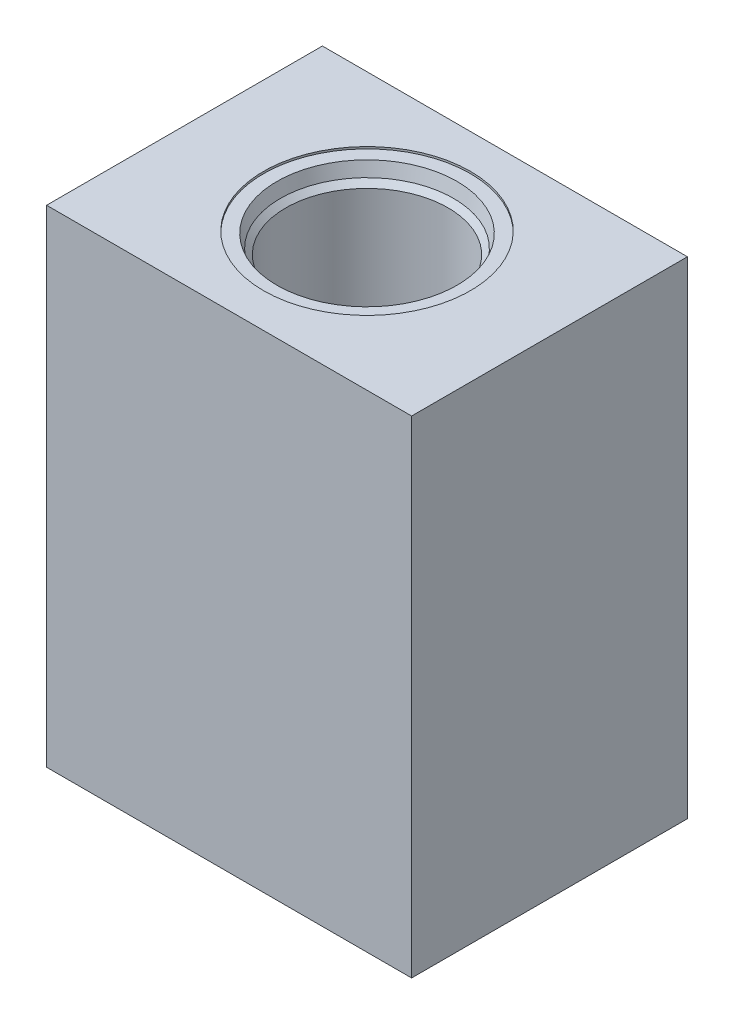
SolidWorks part; units mm, degrees
ref_plane "Ebene vorne" through (0, 0, 0) normal (0, 0, 1) x (1, 0, 0)
ref_plane "Ebene oben" through (0, 0, 0) normal (0, 1, 0) x (1, 0, 0)
ref_plane "Ebene rechts" through (0, 0, 0) normal (1, 0, 0) x (0, 0, -1)
sketch "Skizze1" plane through (0, 0, 0) normal (0, 1, 0) x (1, 0, 0)
  line L0 (0, 29.4215) -> (0, -20.3983) construction
  line L1 (-19.4629, 0) -> (30.3545, 0) construction
  line L3 (-45, 34) -> (45, 34)
  line L4 (-45, 34) -> (-45, -34)
  line L5 (-45, -34) -> (45, -34)
  line L6 (45, 34) -> (45, -34)
  dimension "D1" = 90
  dimension "D2" = 68
extrude "Linear austragen1" add sketch "Skizze1" against normal blind 120
hole_wizard "Bohrung" positions "Skizze424" profile "Skizze3" hole size "Ø21.0" standard "DIN"
sketch "Skizze424" plane through (0, 0, 0) normal (0, 1, 0) x (-1, 0, 0)
  point P0 (0, 0)
sketch "Skizze3" plane through (0, 0, 0) normal (1, 0, 0) x (0, 0, 1)
  line L0 (0, 0) -> (0, 109.6138)
  line L1 (0, 109.6138) -> (16, 100)
  line L2 (16, 100) -> (16, 61.7017)
  line L3 (16, 61.7017) -> (18, 60.5)
  line L4 (18, 60.5) -> (18, 49.995)
  line L5 (25.5, 0) -> (0, 0)
  line L7 (18, 49.995) -> (20, 44.5)
  line L8 (20, 44.5) -> (20, 5.0426)
  line L9 (20, 5.0426) -> (21.3426, 3.7)
  line L10 (0, 109.6138) -> (-16, 100) construction
  line L11 (0, -6.35) -> (0, 107.95) construction
  line L12 (21.3426, 3.7) -> (22.2, 0.5)
  line L13 (22.2, 0.5) -> (25.5, 0.5)
  line L14 (25.5, 0.5) -> (25.5, 0)
  point P8 (0, 33.5)
  point P9 (0, 40)
  point P11 (0, 27)
  point P15 (18, 58.5)
  dimension "Bohrerdurchmesser" = 32
  dimension "Bohrungstiefe" = 100
  dimension "Spitzenwinkel" = 118
